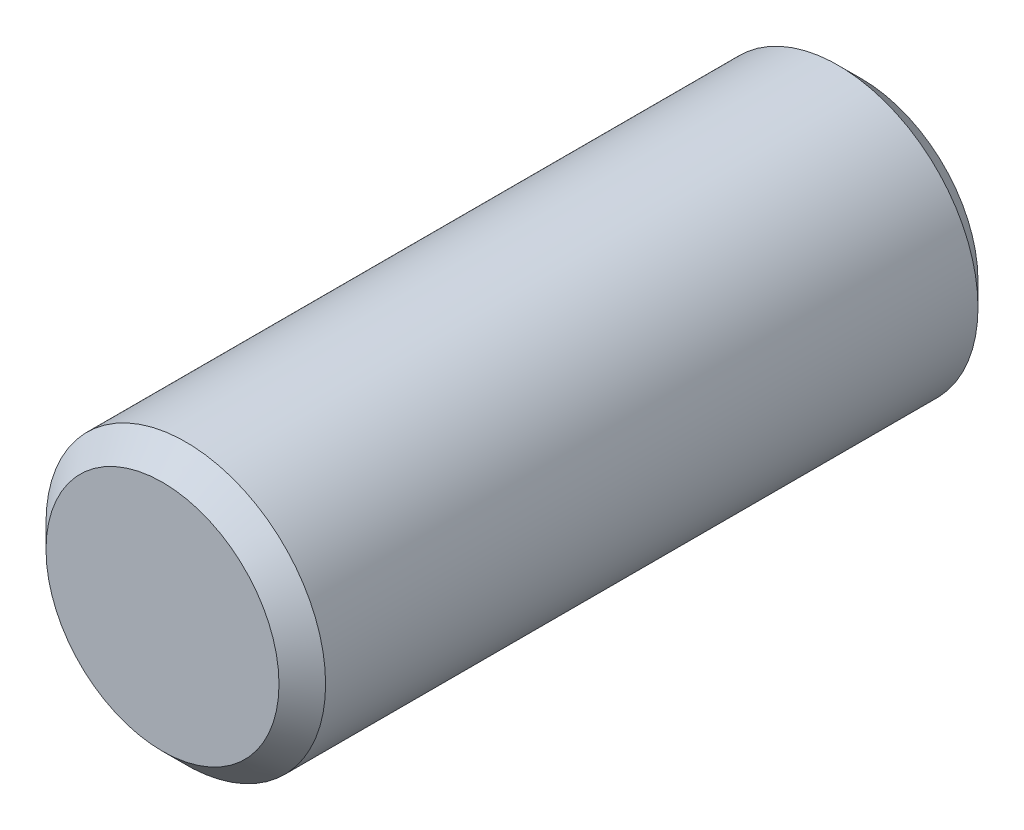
SolidWorks part; units mm, degrees
ref_plane "Plan de face" through (0, 0, 0) normal (0, 0, 1) x (1, 0, 0)
ref_plane "Plan de dessus" through (0, 0, 0) normal (0, 1, 0) x (1, 0, 0)
ref_plane "Plan de droite" through (0, 0, 0) normal (1, 0, 0) x (0, 0, -1)
sketch "Esquisse1" plane through (0, 0, 0) normal (0, 0, 1) x (1, 0, 0)
  circle A0 centre (0, 0) radius 3
  dimension "D1" = 6
extrude "Boss.-Extru.1" add sketch "Esquisse1" along normal blind 15
chamfer "Chanfrein1" distance 0.5 angle 45 2 edges at (3, 0, 0) (3, 0, 15)
